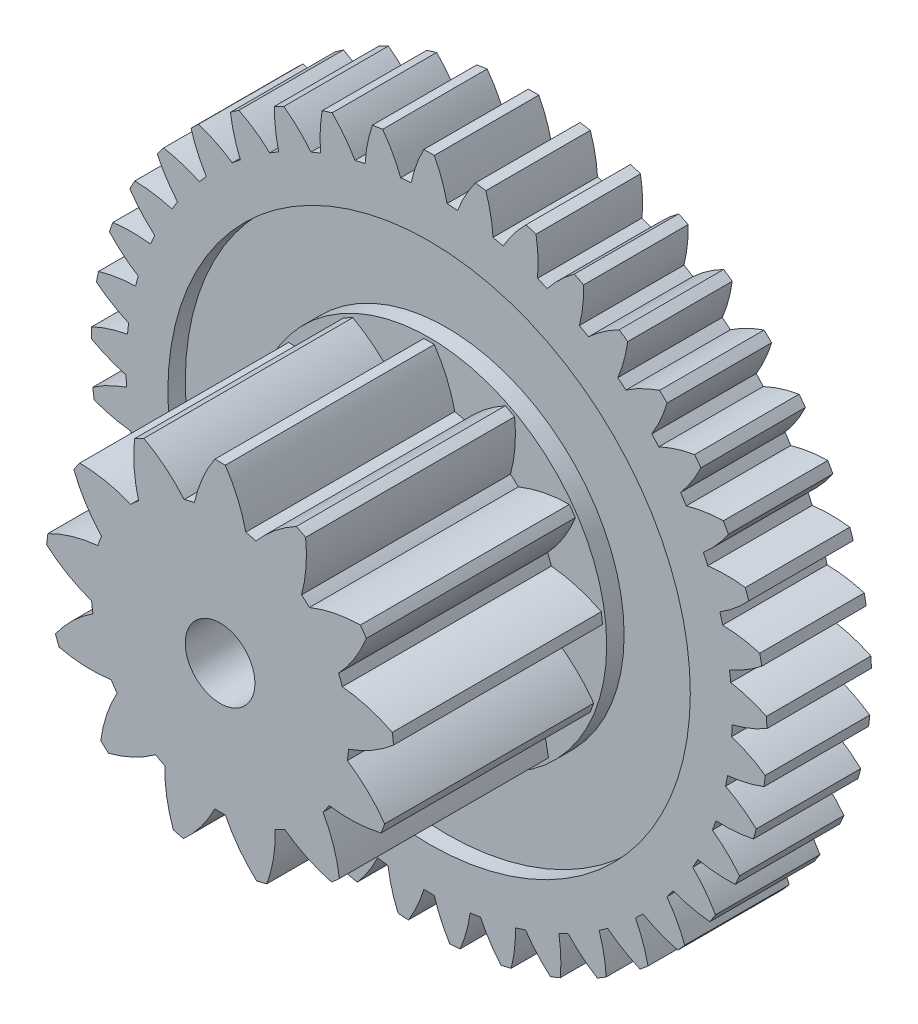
SolidWorks part; units mm, degrees
ref_plane "Plan1" through (0, 0, 0) normal (0, 0, 1) x (1, 0, 0)
ref_plane "Plan2" through (0, 0, 0) normal (0, 1, 0) x (1, 0, 0)
ref_plane "Plan3" through (0, 0, 0) normal (1, 0, 0) x (0, 0, -1)
sketch "Esquisse1" plane through (0, 0, 0) normal (0, 0, 1) x (1, 0, 0)
  circle A0 centre (0, 0) radius 9.7
  dimension "D1" = 19.4
extrude "Base-Extrusion" add sketch "Esquisse1" along normal blind 3
sketch "Esquisse2" plane through (0, 0, 3) normal (0, 0, 1) x (1, 0, 0)
  circle A0 centre (0, 0) radius 5
  dimension "D1" = 10
extrude "Boss.-Extru.1" add sketch "Esquisse2" along normal blind 6
sketch "Esquisse3" plane through (0, 0, 9) normal (0, 0, 1) x (1, 0, 0)
  line L0 (0, 0) -> (0, 7) construction
  line L1 (0, 0) -> (1.5136, 6.1408) construction
  line L2 (0, 0) -> (3.2861, 6.2611) construction
  line L3 (0.8855, 3.5925) -> (1.3269, 5.3833)
  line L4 (-0.8855, 3.5925) -> (-1.3269, 5.3833)
  line L5 (1.3269, 5.3833) -> (-1.3269, 5.3833)
  circle A0 centre (0, 0) radius 3.7 construction
  circle A1 centre (0, 0) radius 5 construction
  arc A2 (0.15, 4.9977) -> (0.7375, 3.6258) centre (-3.1688, 2.7649) cw
  circle A3 centre (0, 0) radius 5 construction
  arc A4 (-0.7375, 3.6258) -> (-0.8855, 3.5925) centre (0, 0) ccw
  arc A5 (-0.15, 4.9977) -> (0.15, 4.9977) centre (0, 0) cw
  arc A6 (0.7375, 3.6258) -> (0.8855, 3.5925) centre (0, 0) cw
  arc A7 (-0.15, 4.9977) -> (-0.7375, 3.6258) centre (3.1688, 2.7649) ccw
  dimension "D1" = 10
  dimension "D2" = 7.4
  dimension "D7" = 4
  dimension "D3" = 13.846
  dimension "D4" = 27.692
  dimension "D5" = 0.15
  dimension "D6" = 0.1516
extrude "Enlèv. mat.-Extru.1" cut sketch "Esquisse3" against normal up to surface (6 mm away)
pattern_circular "Répétition circulaire1" count 13 every 27.692 about axis through (0, 0, 0) along (0, 0, 1) of "Enlèv. mat.-Extru.1"
sketch "Esquisse4" plane through (0, 0, 3) normal (0, 0, 1) x (1, 0, 0)
  line L0 (0, 0) -> (0, 13.9994) construction
  line L1 (0, 0) -> (1.096, 14.2752) construction
  line L2 (0, 0) -> (2.2537, 14.5912) construction
  line L3 (0.666, 8.6745) -> (1.0573, 13.7714)
  line L4 (-0.666, 8.6745) -> (-1.0573, 13.7714)
  line L5 (1.0573, 13.7714) -> (-1.0573, 13.7714)
  circle A0 centre (0, 0) radius 9.7 construction
  circle A1 centre (0, 0) radius 8.7 construction
  arc A2 (-0.5163, 8.6847) -> (-0.666, 8.6745) centre (0, 0) ccw
  arc A3 (-0.15, 9.6988) -> (0.15, 9.6988) centre (0, 0) cw
  arc A4 (0.15, 9.6988) -> (0.5163, 8.6847) centre (-3.3946, 7.8453) cw
  arc A7 (-0.15, 9.6988) -> (-0.5163, 8.6847) centre (3.3946, 7.8453) ccw
  arc A8 (0.5163, 8.6847) -> (0.666, 8.6745) centre (0, 0) cw
  dimension "D1" = 17.4
  dimension "D2" = 19.4
  dimension "D7" = 4
  dimension "D3" = 4.39
  dimension "D4" = 8.78
  dimension "D5" = 0.15
  dimension "D6" = 0.15
extrude "Enlèv. mat.-Extru.2" cut sketch "Esquisse4" against normal through all
pattern_circular "Répétition circulaire2" count 41 every 8.78 about axis through (0, 0, 0) along (0, 0, 1) of "Enlèv. mat.-Extru.2"
sketch "Esquisse5" plane through (0, 0, 9) normal (0, 0, 1) x (1, 0, 0)
  circle A0 centre (0, 0) radius 1
  dimension "D1" = 2
extrude "Enlèv. mat.-Extru.3" cut sketch "Esquisse5" against normal through all
sketch "Esquisse6" plane through (0, 0, 0) normal (0, 0, -1) x (-1, 0, 0)
  circle A0 centre (0, 0) radius 1
  circle A1 centre (0, 0) radius 1 construction
  circle A2 centre (0, 0) radius 2.25
  dimension "D1" = 4.5
extrude "Extrusion1" add sketch "Esquisse6" along normal blind 0.5
sketch "Esquisse7" plane through (0, 0, 3) normal (0, 0, 1) x (1, 0, 0)
  circle A0 centre (0, 0) radius 5.1
  circle A1 centre (0, 0) radius 7.5
  dimension "D1" = 10.2
  dimension "D2" = 15
extrude "Enlèv. mat.-Extru.4" cut sketch "Esquisse7" against normal blind 0.5
